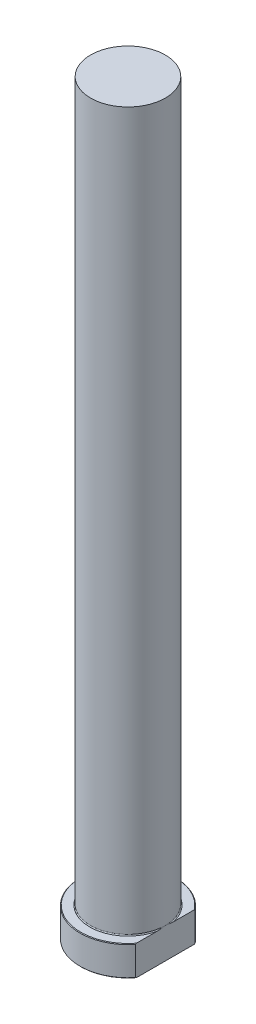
SolidWorks part; units mm, degrees
ref_plane "Front Plane" through (0, 0, 0) normal (0, 0, 1) x (1, 0, 0)
ref_plane "Top Plane" through (0, 0, 0) normal (0, 1, 0) x (1, 0, 0)
ref_plane "Right Plane" through (0, 0, 0) normal (1, 0, 0) x (0, 0, -1)
sketch "Sketch1" plane through (0, 0, 0) normal (0, 0, 1) x (1, 0, 0)
  line L0 (0, 259.9588) -> (0, -15.1925) construction
  line L1 (0, 0) -> (-16, 0)
  line L2 (-16, 0) -> (-16, 10)
  line L3 (-16, 10) -> (-12.5, 10)
  line L4 (-12.5, 10) -> (-12.5, 250)
  line L5 (-12.5, 250) -> (0, 250)
  line L6 (0, 250) -> (0, 0)
  dimension "L" = 250
  dimension "H" = 32
  dimension "T" = 10
  dimension "D" = 25
revolve "Revolve1" add sketch "Sketch1" angle 360 about L0
chamfer "Chamfer1" distance 0.2 angle 45 2 edges at (0, 10, 16) (0, 0, 16)
fillet "Fillet1" radius 0.3 1 edges at (0, 10, 12.5)
sketch "Sketch2" plane through (0, 0, 0) normal (0, 1, 0) x (1, 0, 0)
  line L0 (12.5, 9.9875) -> (12.5, -9.9875)
  circle A0 centre (0, 0) radius 16 construction
  arc A1 (12.5, -9.9875) -> (12.5, 9.9875) centre (0, 0) ccw
  circle A2 centre (0, 0) radius 12.5 construction
extrude "KEY" cut sketch "Sketch2" along normal through all
